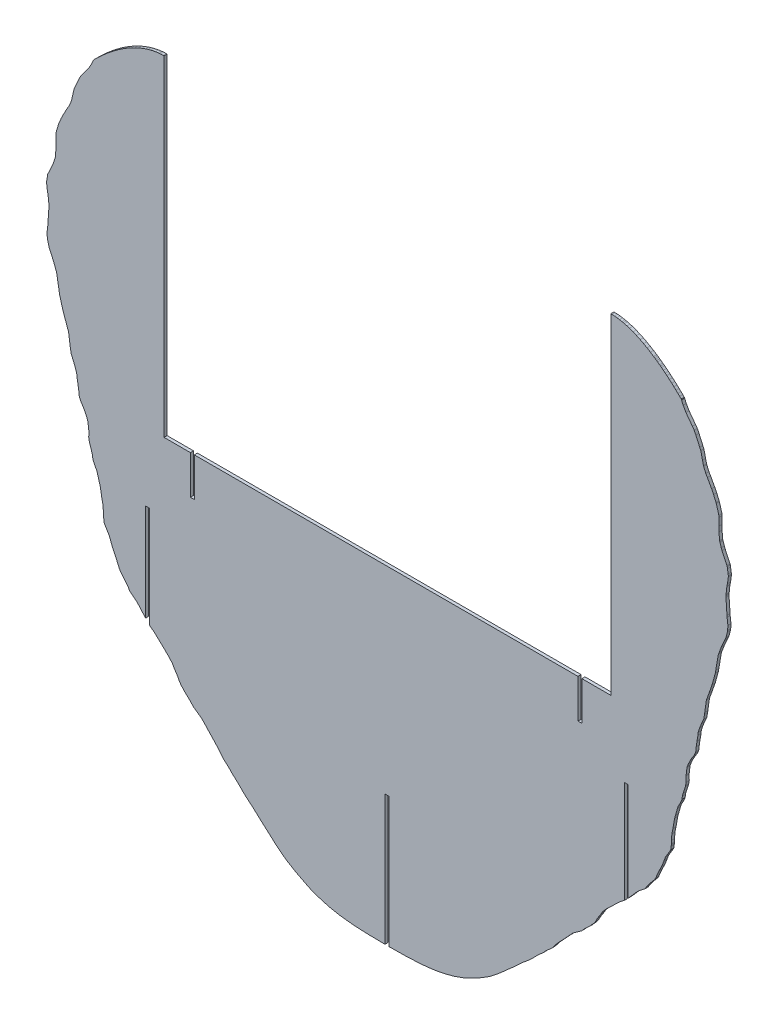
SolidWorks part; units mm, degrees
ref_plane "Спереди" through (0, 0, 0) normal (0, 0, 1) x (1, 0, 0)
ref_plane "Сверху" through (0, 0, 0) normal (0, 1, 0) x (1, 0, 0)
ref_plane "Справа" through (0, 0, 0) normal (1, 0, 0) x (0, 0, -1)
sketch "Model" plane through (0, 0, 0) normal (0, 0, 1) x (1, 0, 0)
  line L0 (-5804.3839, 836.0497) -> (-5806.3839, 836.0497)
  line L1 (-5806.3839, 836.0497) -> (-5806.6339, 836.0497)
  line L2 (-5806.6339, 836.0497) -> (-5806.6339, 751.7719)
  line L3 (-5806.6339, 751.7719) -> (-5816.1644, 751.8978)
  line L4 (-5816.1644, 751.8978) -> (-5817.4992, 751.9156)
  line L5 (-5817.4992, 751.9156) -> (-5818.2747, 751.9559)
  line L6 (-5818.2747, 751.9559) -> (-5819.9537, 752.0402)
  line L7 (-5819.9537, 752.0402) -> (-5827.1833, 752.3916)
  line L8 (-5827.1833, 752.3916) -> (-5831.1328, 752.8359)
  line L9 (-5831.1328, 752.8359) -> (-5835.7292, 753.3756)
  line L10 (-5835.7292, 753.3756) -> (-5839.8833, 754.162)
  line L11 (-5839.8833, 754.162) -> (-5842.8779, 754.7578)
  line L12 (-5842.8779, 754.7578) -> (-5845.0947, 755.3799)
  line L13 (-5845.0947, 755.3799) -> (-5848.0211, 756.1836)
  line L14 (-5848.0211, 756.1836) -> (-5851.9979, 757.5583)
  line L15 (-5851.9979, 757.5583) -> (-5854.8885, 758.6332)
  line L16 (-5854.8885, 758.6332) -> (-5857.0968, 759.7033)
  line L17 (-5857.0968, 759.7033) -> (-5864.759, 763.6433)
  line L18 (-5864.759, 763.6433) -> (-5864.8112, 763.6667)
  line L19 (-5864.8112, 763.6667) -> (-5864.8634, 763.6902)
  line L20 (-5864.8634, 763.6902) -> (-5865.4389, 764.0414)
  line L21 (-5865.4389, 764.0414) -> (-5865.5066, 764.0821)
  line L22 (-5865.5066, 764.0821) -> (-5865.5742, 764.1228)
  line L23 (-5865.5742, 764.1228) -> (-5867.9851, 765.5953)
  line L24 (-5867.9851, 765.5953) -> (-5868.5488, 765.9254)
  line L25 (-5868.5488, 765.9254) -> (-5868.84, 766.117)
  line L26 (-5868.84, 766.117) -> (-5870.1496, 766.9162)
  line L27 (-5870.1496, 766.9162) -> (-5871.8667, 768.1083)
  line L28 (-5871.8667, 768.1083) -> (-5872.1975, 768.3259)
  line L29 (-5872.1975, 768.3259) -> (-5872.3023, 768.4107)
  line L30 (-5872.3023, 768.4107) -> (-5872.502, 768.5493)
  line L31 (-5872.502, 768.5493) -> (-5873.6049, 769.4641)
  line L32 (-5873.6049, 769.4641) -> (-5875.7124, 771.1686)
  line L33 (-5875.7124, 771.1686) -> (-5878.1362, 773.0993)
  line L34 (-5878.1362, 773.0993) -> (-5879.0312, 773.9723)
  line L35 (-5879.0312, 773.9723) -> (-5879.8545, 774.6457)
  line L36 (-5879.8545, 774.6457) -> (-5881.0854, 775.8036)
  line L37 (-5881.0854, 775.8036) -> (-5885.8632, 779.979)
  line L38 (-5885.8632, 779.979) -> (-5889.2742, 783.1358)
  line L39 (-5889.2742, 783.1358) -> (-5891.3116, 784.9701)
  line L40 (-5891.3116, 784.9701) -> (-5892.251, 785.8635)
  line L41 (-5892.251, 785.8635) -> (-5892.3363, 785.9508)
  line L42 (-5892.3363, 785.9508) -> (-5892.4215, 786.0381)
  line L43 (-5892.4215, 786.0381) -> (-5892.837, 786.3891)
  line L44 (-5892.837, 786.3891) -> (-5893.2186, 786.6587)
  line L45 (-5893.2186, 786.6587) -> (-5894.3658, 787.6205)
  line L46 (-5894.3658, 787.6205) -> (-5896.5748, 789.4812)
  line L47 (-5896.5748, 789.4812) -> (-5899.043, 791.8233)
  line L48 (-5899.043, 791.8233) -> (-5901.8105, 794.6416)
  line L49 (-5901.8105, 794.6416) -> (-5903.8277, 796.489)
  line L50 (-5903.8277, 796.489) -> (-5906.0865, 798.4934)
  line L51 (-5906.0865, 798.4934) -> (-5907.1466, 799.7697)
  line L52 (-5907.1466, 799.7697) -> (-5908.1051, 800.6457)
  line L53 (-5908.1051, 800.6457) -> (-5911.608, 803.7685)
  line L54 (-5911.608, 803.7685) -> (-5914.2929, 807.2329)
  line L55 (-5914.2929, 807.2329) -> (-5914.9074, 807.9869)
  line L56 (-5914.9074, 807.9869) -> (-5924.3994, 818.1354)
  line L57 (-5924.3994, 818.1354) -> (-5924.7504, 818.5365)
  line L58 (-5924.7504, 818.5365) -> (-5924.8501, 818.6284)
  line L59 (-5924.8501, 818.6284) -> (-5924.9498, 818.7204)
  line L60 (-5924.9498, 818.7204) -> (-5925.0399, 818.8009)
  line L61 (-5925.0399, 818.8009) -> (-5925.13, 818.8814)
  line L62 (-5925.13, 818.8814) -> (-5927.2887, 820.5208)
  line L63 (-5927.2887, 820.5208) -> (-5930.7649, 822.9693)
  line L64 (-5930.7649, 822.9693) -> (-5932.802, 825.2003)
  line L65 (-5932.802, 825.2003) -> (-5933.9845, 826.4205)
  line L66 (-5933.9845, 826.4205) -> (-5935.7843, 827.9636)
  line L67 (-5935.7843, 827.9636) -> (-5936.8795, 829.2522)
  line L68 (-5936.8795, 829.2522) -> (-5937.7341, 830.2104)
  line L69 (-5937.7341, 830.2104) -> (-5938.3908, 830.8222)
  line L70 (-5938.3908, 830.8222) -> (-5938.6587, 831.1763)
  line L71 (-5938.6587, 831.1763) -> (-5939.4693, 832.2202)
  line L72 (-5939.4693, 832.2202) -> (-5941.3494, 835.6981)
  line L73 (-5941.3494, 835.6981) -> (-5943.388, 838.7749)
  line L74 (-5943.388, 838.7749) -> (-5944.0977, 840.1051)
  line L75 (-5944.0977, 840.1051) -> (-5944.212, 840.3138)
  line L76 (-5944.212, 840.3138) -> (-5944.3263, 840.5225)
  line L77 (-5944.3263, 840.5225) -> (-5945.4997, 841.8494)
  line L78 (-5945.4997, 841.8494) -> (-5947.0465, 843.5373)
  line L79 (-5947.0465, 843.5373) -> (-5947.1959, 843.6832)
  line L80 (-5947.1959, 843.6832) -> (-5953.2154, 849.4644)
  line L81 (-5953.2154, 849.4644) -> (-5955.8353, 851.9385)
  line L82 (-5955.8353, 851.9385) -> (-5956.4874, 852.4492)
  line L83 (-5956.4874, 852.4492) -> (-5958.6224, 854.0276)
  line L84 (-5958.6224, 854.0276) -> (-5959.1338, 854.482)
  line L85 (-5959.1338, 854.482) -> (-5959.1338, 920.079)
  line L86 (-5959.1338, 920.079) -> (-5959.3839, 920.079)
  line L87 (-5959.3839, 920.079) -> (-5961.3839, 920.079)
  line L88 (-5961.3839, 920.079) -> (-5961.6338, 920.079)
  line L89 (-5961.6338, 920.079) -> (-5961.6338, 857.184)
  line L90 (-5961.6338, 857.184) -> (-5964.966, 860.9151)
  line L91 (-5964.966, 860.9151) -> (-5966.7855, 863.0199)
  line L92 (-5966.7855, 863.0199) -> (-5968.0384, 864.1402)
  line L93 (-5968.0384, 864.1402) -> (-5971.9293, 867.2232)
  line L94 (-5971.9293, 867.2232) -> (-5972.0501, 867.4447)
  line L95 (-5972.0501, 867.4447) -> (-5972.1709, 867.6662)
  line L96 (-5972.1709, 867.6662) -> (-5972.774, 868.7467)
  line L97 (-5972.774, 868.7467) -> (-5974.7782, 871.3066)
  line L98 (-5974.7782, 871.3066) -> (-5974.9323, 871.5767)
  line L99 (-5974.9323, 871.5767) -> (-5975.0864, 871.8468)
  line L100 (-5975.0864, 871.8468) -> (-5975.8134, 872.6961)
  line L101 (-5975.8134, 872.6961) -> (-5978.0533, 875.3468)
  line L102 (-5978.0533, 875.3468) -> (-5978.7387, 876.5985)
  line L103 (-5978.7387, 876.5985) -> (-5980.8785, 881.6838)
  line L104 (-5980.8785, 881.6838) -> (-5980.9926, 881.8731)
  line L105 (-5980.9926, 881.8731) -> (-5981.1067, 882.0625)
  line L106 (-5981.1067, 882.0625) -> (-5982.643, 885.1963)
  line L107 (-5982.643, 885.1963) -> (-5983.9639, 888.4629)
  line L108 (-5983.9639, 888.4629) -> (-5984.2915, 889.5132)
  line L109 (-5984.2915, 889.5132) -> (-5985.1196, 891.5619)
  line L110 (-5985.1196, 891.5619) -> (-5985.6036, 892.4184)
  line L111 (-5985.6036, 892.4184) -> (-5987.355, 895.3535)
  line L112 (-5987.355, 895.3535) -> (-5988.2102, 896.7719)
  line L113 (-5988.2102, 896.7719) -> (-5988.442, 897.175)
  line L114 (-5988.442, 897.175) -> (-5988.4738, 897.3949)
  line L115 (-5988.4738, 897.3949) -> (-5988.7135, 899.2955)
  line L116 (-5988.7135, 899.2955) -> (-5988.7262, 899.3572)
  line L117 (-5988.7262, 899.3572) -> (-5988.7388, 899.4189)
  line L118 (-5988.7388, 899.4189) -> (-5988.8459, 900.1889)
  line L119 (-5988.8459, 900.1889) -> (-5988.8464, 900.2457)
  line L120 (-5988.8464, 900.2457) -> (-5988.8469, 900.3025)
  line L121 (-5988.8469, 900.3025) -> (-5988.9215, 900.6902)
  line L122 (-5988.9215, 900.6902) -> (-5988.9959, 901.078)
  line L123 (-5988.9959, 901.078) -> (-5988.9859, 902.8461)
  line L124 (-5988.9859, 902.8461) -> (-5989.1853, 906.5229)
  line L125 (-5989.1853, 906.5229) -> (-5989.9012, 909.8884)
  line L126 (-5989.9012, 909.8884) -> (-5990.9936, 916.2501)
  line L127 (-5990.9936, 916.2501) -> (-5991.5211, 918.0653)
  line L128 (-5991.5211, 918.0653) -> (-5992.83, 922.7678)
  line L129 (-5992.83, 922.7678) -> (-5993.252, 924.0637)
  line L130 (-5993.252, 924.0637) -> (-5994.1601, 925.7245)
  line L131 (-5994.1601, 925.7245) -> (-5995.1207, 927.6513)
  line L132 (-5995.1207, 927.6513) -> (-5995.8326, 929.2669)
  line L133 (-5995.8326, 929.2669) -> (-5995.9583, 931.067)
  line L134 (-5995.9583, 931.067) -> (-5996.5013, 932.9513)
  line L135 (-5996.5013, 932.9513) -> (-5998.0129, 937.6749)
  line L136 (-5998.0129, 937.6749) -> (-5998.0847, 938.1014)
  line L137 (-5998.0847, 938.1014) -> (-5998.4743, 940.2265)
  line L138 (-5998.4743, 940.2265) -> (-5998.4124, 943.7055)
  line L139 (-5998.4124, 943.7055) -> (-5998.4296, 944.146)
  line L140 (-5998.4296, 944.146) -> (-5998.9917, 948.6151)
  line L141 (-5998.9917, 948.6151) -> (-5999.1586, 949.3263)
  line L142 (-5999.1586, 949.3263) -> (-5999.83, 951.0285)
  line L143 (-5999.83, 951.0285) -> (-6001.0629, 953.631)
  line L144 (-6001.0629, 953.631) -> (-6002.2515, 955.7358)
  line L145 (-6002.2515, 955.7358) -> (-6003.6462, 957.8541)
  line L146 (-6003.6462, 957.8541) -> (-6004.3385, 959.4092)
  line L147 (-6004.3385, 959.4092) -> (-6004.6578, 960.4184)
  line L148 (-6004.6578, 960.4184) -> (-6004.9614, 963.3342)
  line L149 (-6004.9614, 963.3342) -> (-6005.453, 966.6202)
  line L150 (-6005.453, 966.6202) -> (-6005.4643, 966.6896)
  line L151 (-6005.4643, 966.6896) -> (-6005.4755, 966.7589)
  line L152 (-6005.4755, 966.7589) -> (-6006.1374, 970.4479)
  line L153 (-6006.1374, 970.4479) -> (-6006.2382, 971.868)
  line L154 (-6006.2382, 971.868) -> (-6006.2708, 972.0867)
  line L155 (-6006.2708, 972.0867) -> (-6007.2003, 974.9839)
  line L156 (-6007.2003, 974.9839) -> (-6008.3074, 977.884)
  line L157 (-6008.3074, 977.884) -> (-6009.8059, 981.2033)
  line L158 (-6009.8059, 981.2033) -> (-6010.3632, 984.2243)
  line L159 (-6010.3632, 984.2243) -> (-6010.4328, 984.77)
  line L160 (-6010.4328, 984.77) -> (-6010.5025, 985.3157)
  line L161 (-6010.5025, 985.3157) -> (-6011.5455, 992.776)
  line L162 (-6011.5455, 992.776) -> (-6013.3448, 997.7876)
  line L163 (-6013.3448, 997.7876) -> (-6015.258, 1003.2142)
  line L164 (-6015.258, 1003.2142) -> (-6017.3245, 1010.7463)
  line L165 (-6017.3245, 1010.7463) -> (-6017.3444, 1010.8489)
  line L166 (-6017.3444, 1010.8489) -> (-6017.3643, 1010.9514)
  line L167 (-6017.3643, 1010.9514) -> (-6017.6275, 1012.5505)
  line L168 (-6017.6275, 1012.5505) -> (-6019.3031, 1022.4056)
  line L169 (-6019.3031, 1022.4056) -> (-6019.9412, 1023.8694)
  line L170 (-6019.9412, 1023.8694) -> (-6021.1501, 1027.2933)
  line L171 (-6021.1501, 1027.2933) -> (-6023.4014, 1032.1994)
  line L172 (-6023.4014, 1032.1994) -> (-6024.0142, 1033.546)
  line L173 (-6024.0142, 1033.546) -> (-6024.2282, 1034.1694)
  line L174 (-6024.2282, 1034.1694) -> (-6025.2233, 1038.1004)
  line L175 (-6025.2233, 1038.1004) -> (-6025.269, 1038.4718)
  line L176 (-6025.269, 1038.4718) -> (-6025.3148, 1038.8431)
  line L177 (-6025.3148, 1038.8431) -> (-6025.4861, 1041.5935)
  line L178 (-6025.4861, 1041.5935) -> (-6024.9598, 1045.8597)
  line L179 (-6024.9598, 1045.8597) -> (-6024.8884, 1047.014)
  line L180 (-6024.8884, 1047.014) -> (-6024.2263, 1056.8146)
  line L181 (-6024.2263, 1056.8146) -> (-6024.1768, 1057.4505)
  line L182 (-6024.1768, 1057.4505) -> (-6024.1836, 1057.5831)
  line L183 (-6024.1836, 1057.5831) -> (-6024.1903, 1057.7154)
  line L184 (-6024.1903, 1057.7154) -> (-6024.3245, 1058.516)
  line L185 (-6024.3245, 1058.516) -> (-6024.8177, 1063.1317)
  line L186 (-6024.8177, 1063.1317) -> (-6025.2345, 1064.9608)
  line L187 (-6025.2345, 1064.9608) -> (-6025.7636, 1069.0267)
  line L188 (-6025.7636, 1069.0267) -> (-6025.7849, 1069.1886)
  line L189 (-6025.7849, 1069.1886) -> (-6025.8062, 1069.3504)
  line L190 (-6025.8062, 1069.3504) -> (-6025.8044, 1069.4669)
  line L191 (-6025.8044, 1069.4669) -> (-6025.7945, 1069.5785)
  line L192 (-6025.7945, 1069.5785) -> (-6025.7846, 1069.69)
  line L193 (-6025.7846, 1069.69) -> (-6025.6458, 1070.5899)
  line L194 (-6025.6458, 1070.5899) -> (-6025.2242, 1073.3153)
  line L195 (-6025.2242, 1073.3153) -> (-6025.0565, 1074.347)
  line L196 (-6025.0565, 1074.347) -> (-6025.0275, 1074.4322)
  line L197 (-6025.0275, 1074.4322) -> (-6024.9987, 1074.5174)
  line L198 (-6024.9987, 1074.5174) -> (-6024.8829, 1074.7634)
  line L199 (-6024.8829, 1074.7634) -> (-6024.7672, 1075.0094)
  line L200 (-6024.7672, 1075.0094) -> (-6021.7061, 1081.6551)
  line L201 (-6021.7061, 1081.6551) -> (-6021.1853, 1083.0296)
  line L202 (-6021.1853, 1083.0296) -> (-6020.3734, 1085.5169)
  line L203 (-6020.3734, 1085.5169) -> (-6020.1867, 1085.9986)
  line L204 (-6020.1867, 1085.9986) -> (-6020.0859, 1086.5262)
  line L205 (-6020.0859, 1086.5262) -> (-6019.7193, 1091.2474)
  line L206 (-6019.7193, 1091.2474) -> (-6019.676, 1094.4)
  line L207 (-6019.676, 1094.4) -> (-6019.7209, 1099.3265)
  line L208 (-6019.7209, 1099.3265) -> (-6019.6312, 1100.5154)
  line L209 (-6019.6312, 1100.5154) -> (-6017.9762, 1106.2511)
  line L210 (-6017.9762, 1106.2511) -> (-6017.8916, 1106.4439)
  line L211 (-6017.8916, 1106.4439) -> (-6017.807, 1106.6369)
  line L212 (-6017.807, 1106.6369) -> (-6016.2192, 1110.3697)
  line L213 (-6016.2192, 1110.3697) -> (-6014.9184, 1113.0326)
  line L214 (-6014.9184, 1113.0326) -> (-6012.2263, 1117.9522)
  line L215 (-6012.2263, 1117.9522) -> (-6011.1822, 1119.7015)
  line L216 (-6011.1822, 1119.7015) -> (-6009.7951, 1123.0426)
  line L217 (-6009.7951, 1123.0426) -> (-6009.6511, 1123.3592)
  line L218 (-6009.6511, 1123.3592) -> (-6009.0478, 1126.0429)
  line L219 (-6009.0478, 1126.0429) -> (-6007.9239, 1130.9686)
  line L220 (-6007.9239, 1130.9686) -> (-6007.26, 1132.398)
  line L221 (-6007.26, 1132.398) -> (-6004.7557, 1138.0055)
  line L222 (-6004.7557, 1138.0055) -> (-6003.6607, 1140.2436)
  line L223 (-6003.6607, 1140.2436) -> (-6002.5034, 1141.855)
  line L224 (-6002.5034, 1141.855) -> (-5998.3656, 1147.4083)
  line L225 (-5998.3656, 1147.4083) -> (-5996.5661, 1150.6158)
  line L226 (-5996.5661, 1150.6158) -> (-5995.5018, 1152.9276)
  line L227 (-5995.5018, 1152.9276) -> (-5995.435, 1153.0099)
  line L228 (-5995.435, 1153.0099) -> (-5995.2473, 1153.5038)
  line L229 (-5995.2473, 1153.5038) -> (-5994.2278, 1154.5143)
  line L230 (-5994.2278, 1154.5143) -> (-5993.1001, 1155.6102)
  line L231 (-5993.1001, 1155.6102) -> (-5991.8687, 1156.7803)
  line L232 (-5991.8687, 1156.7803) -> (-5990.5382, 1158.0133)
  line L233 (-5990.5382, 1158.0133) -> (-5989.1133, 1159.2981)
  line L234 (-5989.1133, 1159.2981) -> (-5987.5984, 1160.6231)
  line L235 (-5987.5984, 1160.6231) -> (-5985.9981, 1161.9774)
  line L236 (-5985.9981, 1161.9774) -> (-5984.8659, 1162.9073)
  line L237 (-5984.8659, 1162.9073) -> (-5983.6978, 1163.8418)
  line L238 (-5983.6978, 1163.8418) -> (-5982.4954, 1164.7773)
  line L239 (-5982.4954, 1164.7773) -> (-5981.8778, 1165.244)
  line L240 (-5981.8778, 1165.244) -> (-5981.2601, 1165.7105)
  line L241 (-5981.2601, 1165.7105) -> (-5979.9932, 1166.6378)
  line L242 (-5979.9932, 1166.6378) -> (-5979.3448, 1167.0968)
  line L243 (-5979.3448, 1167.0968) -> (-5978.6964, 1167.5559)
  line L244 (-5978.6964, 1167.5559) -> (-5978.0336, 1168.0084)
  line L245 (-5978.0336, 1168.0084) -> (-5977.3709, 1168.4608)
  line L246 (-5977.3709, 1168.4608) -> (-5975.2792, 1169.8194)
  line L247 (-5975.2792, 1169.8194) -> (-5973.1284, 1171.1263)
  line L248 (-5973.1284, 1171.1263) -> (-5970.9235, 1172.3683)
  line L249 (-5970.9235, 1172.3683) -> (-5968.67, 1173.5328)
  line L250 (-5968.67, 1173.5328) -> (-5966.3729, 1174.6068)
  line L251 (-5966.3729, 1174.6068) -> (-5964.0374, 1175.5777)
  line L252 (-5964.0374, 1175.5777) -> (-5961.6688, 1176.4325)
  line L253 (-5961.6688, 1176.4325) -> (-5960.0828, 1176.9288)
  line L254 (-5960.0828, 1176.9288) -> (-5958.4856, 1177.3651)
  line L255 (-5958.4856, 1177.3651) -> (-5956.8786, 1177.7374)
  line L256 (-5956.8786, 1177.7374) -> (-5955.2639, 1178.0416)
  line L257 (-5955.2639, 1178.0416) -> (-5953.6431, 1178.2743)
  line L258 (-5953.6431, 1178.2743) -> (-5952.8305, 1178.3529)
  line L259 (-5952.8305, 1178.3529) -> (-5952.0179, 1178.4316)
  line L260 (-5952.0179, 1178.4316) -> (-5950.39, 1178.5095)
  line L261 (-5950.39, 1178.5095) -> (-5950.0315, 1178.5128)
  line L262 (-5950.0315, 1178.5128) -> (-5949.6728, 1178.516)
  line L263 (-5949.6728, 1178.516) -> (-5949.6728, 964.5249)
  line L264 (-5949.6728, 964.5249) -> (-5932.6339, 964.5249)
  line L265 (-5932.6339, 964.5249) -> (-5932.6339, 939.4676)
  line L266 (-5932.6339, 939.4676) -> (-5932.3839, 939.4676)
  line L267 (-5932.3839, 939.4676) -> (-5930.3839, 939.4676)
  line L268 (-5930.3839, 939.4676) -> (-5930.1339, 939.4676)
  line L269 (-5930.1339, 939.4676) -> (-5930.1339, 964.5249)
  line L270 (-5930.1339, 964.5249) -> (-5681.634, 964.5249)
  line L271 (-5681.634, 964.5249) -> (-5681.634, 939.4676)
  line L272 (-5681.634, 939.4676) -> (-5681.3839, 939.4676)
  line L273 (-5681.3839, 939.4676) -> (-5679.3839, 939.4676)
  line L274 (-5679.3839, 939.4676) -> (-5679.134, 939.4676)
  line L275 (-5679.134, 939.4676) -> (-5679.134, 964.5249)
  line L276 (-5679.134, 964.5249) -> (-5660.3839, 964.5249)
  line L277 (-5660.3839, 964.5249) -> (-5660.3839, 1178.516)
  line L278 (-5660.3839, 1178.516) -> (-5659.6697, 1178.5096)
  line L279 (-5659.6697, 1178.5096) -> (-5658.0416, 1178.4317)
  line L280 (-5658.0416, 1178.4317) -> (-5656.4159, 1178.2745)
  line L281 (-5656.4159, 1178.2745) -> (-5655.6052, 1178.1581)
  line L282 (-5655.6052, 1178.1581) -> (-5654.7945, 1178.0417)
  line L283 (-5654.7945, 1178.0417) -> (-5653.1792, 1177.7373)
  line L284 (-5653.1792, 1177.7373) -> (-5652.3754, 1177.5511)
  line L285 (-5652.3754, 1177.5511) -> (-5651.5717, 1177.3651)
  line L286 (-5651.5717, 1177.3651) -> (-5649.9739, 1176.9288)
  line L287 (-5649.9739, 1176.9288) -> (-5648.3878, 1176.4325)
  line L288 (-5648.3878, 1176.4325) -> (-5646.0192, 1175.5777)
  line L289 (-5646.0192, 1175.5777) -> (-5643.6836, 1174.607)
  line L290 (-5643.6836, 1174.607) -> (-5641.3866, 1173.5328)
  line L291 (-5641.3866, 1173.5328) -> (-5639.133, 1172.3683)
  line L292 (-5639.133, 1172.3683) -> (-5636.9283, 1171.1261)
  line L293 (-5636.9283, 1171.1261) -> (-5634.7774, 1169.8194)
  line L294 (-5634.7774, 1169.8194) -> (-5632.6858, 1168.4608)
  line L295 (-5632.6858, 1168.4608) -> (-5632.023, 1168.0084)
  line L296 (-5632.023, 1168.0084) -> (-5631.3602, 1167.5559)
  line L297 (-5631.3602, 1167.5559) -> (-5630.7117, 1167.097)
  line L298 (-5630.7117, 1167.097) -> (-5630.0633, 1166.638)
  line L299 (-5630.0633, 1166.638) -> (-5628.7965, 1165.7105)
  line L300 (-5628.7965, 1165.7105) -> (-5628.1789, 1165.244)
  line L301 (-5628.1789, 1165.244) -> (-5627.5612, 1164.7773)
  line L302 (-5627.5612, 1164.7773) -> (-5626.3588, 1163.8417)
  line L303 (-5626.3588, 1163.8417) -> (-5625.1908, 1162.9072)
  line L304 (-5625.1908, 1162.9072) -> (-5624.0585, 1161.9774)
  line L305 (-5624.0585, 1161.9774) -> (-5622.4581, 1160.6234)
  line L306 (-5622.4581, 1160.6234) -> (-5620.9433, 1159.2981)
  line L307 (-5620.9433, 1159.2981) -> (-5619.5184, 1158.0133)
  line L308 (-5619.5184, 1158.0133) -> (-5618.1879, 1156.7803)
  line L309 (-5618.1879, 1156.7803) -> (-5616.9566, 1155.6101)
  line L310 (-5616.9566, 1155.6101) -> (-5615.8288, 1154.5143)
  line L311 (-5615.8288, 1154.5143) -> (-5614.8093, 1153.5038)
  line L312 (-5614.8093, 1153.5038) -> (-5614.6216, 1153.0099)
  line L313 (-5614.6216, 1153.0099) -> (-5614.5549, 1152.9276)
  line L314 (-5614.5549, 1152.9276) -> (-5613.4905, 1150.6158)
  line L315 (-5613.4905, 1150.6158) -> (-5611.6911, 1147.4083)
  line L316 (-5611.6911, 1147.4083) -> (-5607.5533, 1141.855)
  line L317 (-5607.5533, 1141.855) -> (-5606.396, 1140.2436)
  line L318 (-5606.396, 1140.2436) -> (-5605.301, 1138.0055)
  line L319 (-5605.301, 1138.0055) -> (-5602.7967, 1132.398)
  line L320 (-5602.7967, 1132.398) -> (-5602.1327, 1130.9686)
  line L321 (-5602.1327, 1130.9686) -> (-5601.0087, 1126.0429)
  line L322 (-5601.0087, 1126.0429) -> (-5600.4056, 1123.3592)
  line L323 (-5600.4056, 1123.3592) -> (-5600.2615, 1123.0426)
  line L324 (-5600.2615, 1123.0426) -> (-5598.8744, 1119.7015)
  line L325 (-5598.8744, 1119.7015) -> (-5597.8303, 1117.9522)
  line L326 (-5597.8303, 1117.9522) -> (-5595.1382, 1113.0326)
  line L327 (-5595.1382, 1113.0326) -> (-5593.8374, 1110.3697)
  line L328 (-5593.8374, 1110.3697) -> (-5592.2496, 1106.6369)
  line L329 (-5592.2496, 1106.6369) -> (-5592.1651, 1106.4439)
  line L330 (-5592.1651, 1106.4439) -> (-5592.0805, 1106.2511)
  line L331 (-5592.0805, 1106.2511) -> (-5590.4255, 1100.5154)
  line L332 (-5590.4255, 1100.5154) -> (-5590.3357, 1099.3265)
  line L333 (-5590.3357, 1099.3265) -> (-5590.3807, 1094.4)
  line L334 (-5590.3807, 1094.4) -> (-5590.3373, 1091.2474)
  line L335 (-5590.3373, 1091.2474) -> (-5589.9707, 1086.5262)
  line L336 (-5589.9707, 1086.5262) -> (-5589.8699, 1085.9986)
  line L337 (-5589.8699, 1085.9986) -> (-5589.6832, 1085.5169)
  line L338 (-5589.6832, 1085.5169) -> (-5588.8714, 1083.0296)
  line L339 (-5588.8714, 1083.0296) -> (-5588.3504, 1081.6551)
  line L340 (-5588.3504, 1081.6551) -> (-5585.2895, 1075.0094)
  line L341 (-5585.2895, 1075.0094) -> (-5585.0579, 1074.5174)
  line L342 (-5585.0579, 1074.5174) -> (-5585.0002, 1074.347)
  line L343 (-5585.0002, 1074.347) -> (-5584.8324, 1073.3153)
  line L344 (-5584.8324, 1073.3153) -> (-5584.4108, 1070.5899)
  line L345 (-5584.4108, 1070.5899) -> (-5584.2755, 1069.7269)
  line L346 (-5584.2755, 1069.7269) -> (-5584.2523, 1069.4669)
  line L347 (-5584.2523, 1069.4669) -> (-5584.2504, 1069.3553)
  line L348 (-5584.2504, 1069.3553) -> (-5584.293, 1069.0267)
  line L349 (-5584.293, 1069.0267) -> (-5584.8222, 1064.9608)
  line L350 (-5584.8222, 1064.9608) -> (-5585.239, 1063.1317)
  line L351 (-5585.239, 1063.1317) -> (-5585.7322, 1058.516)
  line L352 (-5585.7322, 1058.516) -> (-5585.8663, 1057.7154)
  line L353 (-5585.8663, 1057.7154) -> (-5585.8798, 1057.4505)
  line L354 (-5585.8798, 1057.4505) -> (-5585.8303, 1056.8146)
  line L355 (-5585.8303, 1056.8146) -> (-5585.1682, 1047.014)
  line L356 (-5585.1682, 1047.014) -> (-5585.0969, 1045.8597)
  line L357 (-5585.0969, 1045.8597) -> (-5584.5705, 1041.5935)
  line L358 (-5584.5705, 1041.5935) -> (-5584.7419, 1038.8431)
  line L359 (-5584.7419, 1038.8431) -> (-5584.8333, 1038.1004)
  line L360 (-5584.8333, 1038.1004) -> (-5585.8284, 1034.1694)
  line L361 (-5585.8284, 1034.1694) -> (-5586.0424, 1033.546)
  line L362 (-5586.0424, 1033.546) -> (-5586.6552, 1032.1994)
  line L363 (-5586.6552, 1032.1994) -> (-5588.9065, 1027.2933)
  line L364 (-5588.9065, 1027.2933) -> (-5590.1154, 1023.8694)
  line L365 (-5590.1154, 1023.8694) -> (-5590.7536, 1022.4056)
  line L366 (-5590.7536, 1022.4056) -> (-5592.4292, 1012.5505)
  line L367 (-5592.4292, 1012.5505) -> (-5592.6923, 1010.9514)
  line L368 (-5592.6923, 1010.9514) -> (-5592.7321, 1010.7463)
  line L369 (-5592.7321, 1010.7463) -> (-5594.7986, 1003.2142)
  line L370 (-5594.7986, 1003.2142) -> (-5596.7119, 997.7876)
  line L371 (-5596.7119, 997.7876) -> (-5598.5111, 992.776)
  line L372 (-5598.5111, 992.776) -> (-5599.5541, 985.3157)
  line L373 (-5599.5541, 985.3157) -> (-5599.6934, 984.2243)
  line L374 (-5599.6934, 984.2243) -> (-5600.2508, 981.2033)
  line L375 (-5600.2508, 981.2033) -> (-5601.7492, 977.884)
  line L376 (-5601.7492, 977.884) -> (-5602.8563, 974.9839)
  line L377 (-5602.8563, 974.9839) -> (-5603.7844, 972.0929)
  line L378 (-5603.7844, 972.0929) -> (-5603.8184, 971.868)
  line L379 (-5603.8184, 971.868) -> (-5603.9193, 970.4479)
  line L380 (-5603.9193, 970.4479) -> (-5604.5811, 966.7589)
  line L381 (-5604.5811, 966.7589) -> (-5604.6036, 966.6202)
  line L382 (-5604.6036, 966.6202) -> (-5605.0953, 963.3342)
  line L383 (-5605.0953, 963.3342) -> (-5605.3988, 960.4184)
  line L384 (-5605.3988, 960.4184) -> (-5605.7182, 959.4092)
  line L385 (-5605.7182, 959.4092) -> (-5606.4105, 957.8541)
  line L386 (-5606.4105, 957.8541) -> (-5607.8051, 955.7358)
  line L387 (-5607.8051, 955.7358) -> (-5608.9937, 953.631)
  line L388 (-5608.9937, 953.631) -> (-5610.2265, 951.0285)
  line L389 (-5610.2265, 951.0285) -> (-5610.898, 949.3263)
  line L390 (-5610.898, 949.3263) -> (-5611.065, 948.6151)
  line L391 (-5611.065, 948.6151) -> (-5611.627, 944.146)
  line L392 (-5611.627, 944.146) -> (-5611.6442, 943.7055)
  line L393 (-5611.6442, 943.7055) -> (-5611.5824, 940.2265)
  line L394 (-5611.5824, 940.2265) -> (-5611.9719, 938.1014)
  line L395 (-5611.9719, 938.1014) -> (-5612.0437, 937.6749)
  line L396 (-5612.0437, 937.6749) -> (-5613.5554, 932.9513)
  line L397 (-5613.5554, 932.9513) -> (-5614.0983, 931.067)
  line L398 (-5614.0983, 931.067) -> (-5614.2241, 929.2669)
  line L399 (-5614.2241, 929.2669) -> (-5614.9359, 927.6513)
  line L400 (-5614.9359, 927.6513) -> (-5615.8965, 925.7245)
  line L401 (-5615.8965, 925.7245) -> (-5616.8046, 924.0637)
  line L402 (-5616.8046, 924.0637) -> (-5617.2266, 922.7678)
  line L403 (-5617.2266, 922.7678) -> (-5618.5355, 918.0653)
  line L404 (-5618.5355, 918.0653) -> (-5619.0631, 916.2501)
  line L405 (-5619.0631, 916.2501) -> (-5620.1554, 909.8884)
  line L406 (-5620.1554, 909.8884) -> (-5620.8714, 906.5229)
  line L407 (-5620.8714, 906.5229) -> (-5621.0707, 902.8461)
  line L408 (-5621.0707, 902.8461) -> (-5621.0607, 901.078)
  line L409 (-5621.0607, 901.078) -> (-5621.2097, 900.3025)
  line L410 (-5621.2097, 900.3025) -> (-5621.2108, 900.1889)
  line L411 (-5621.2108, 900.1889) -> (-5621.3177, 899.4189)
  line L412 (-5621.3177, 899.4189) -> (-5621.3432, 899.2955)
  line L413 (-5621.3432, 899.2955) -> (-5621.5828, 897.3949)
  line L414 (-5621.5828, 897.3949) -> (-5621.6147, 897.175)
  line L415 (-5621.6147, 897.175) -> (-5621.8465, 896.7719)
  line L416 (-5621.8465, 896.7719) -> (-5622.7016, 895.3535)
  line L417 (-5622.7016, 895.3535) -> (-5624.4531, 892.4184)
  line L418 (-5624.4531, 892.4184) -> (-5624.937, 891.5619)
  line L419 (-5624.937, 891.5619) -> (-5625.7652, 889.5132)
  line L420 (-5625.7652, 889.5132) -> (-5626.0927, 888.4629)
  line L421 (-5626.0927, 888.4629) -> (-5627.4136, 885.1963)
  line L422 (-5627.4136, 885.1963) -> (-5628.95, 882.0625)
  line L423 (-5628.95, 882.0625) -> (-5629.1781, 881.6838)
  line L424 (-5629.1781, 881.6838) -> (-5631.318, 876.5985)
  line L425 (-5631.318, 876.5985) -> (-5632.0033, 875.3468)
  line L426 (-5632.0033, 875.3468) -> (-5634.2433, 872.6961)
  line L427 (-5634.2433, 872.6961) -> (-5634.9702, 871.8468)
  line L428 (-5634.9702, 871.8468) -> (-5635.2785, 871.3066)
  line L429 (-5635.2785, 871.3066) -> (-5637.2826, 868.7467)
  line L430 (-5637.2826, 868.7467) -> (-5637.8858, 867.6662)
  line L431 (-5637.8858, 867.6662) -> (-5638.1093, 867.2453)
  line L432 (-5638.1093, 867.2453) -> (-5642.0182, 864.1402)
  line L433 (-5642.0182, 864.1402) -> (-5643.2712, 863.0199)
  line L434 (-5643.2712, 863.0199) -> (-5645.0907, 860.9151)
  line L435 (-5645.0907, 860.9151) -> (-5649.1339, 856.3877)
  line L436 (-5649.1339, 856.3877) -> (-5649.1339, 920.079)
  line L437 (-5649.1339, 920.079) -> (-5649.3839, 920.079)
  line L438 (-5649.3839, 920.079) -> (-5651.3839, 920.079)
  line L439 (-5651.3839, 920.079) -> (-5651.6339, 920.079)
  line L440 (-5651.6339, 920.079) -> (-5651.6339, 853.88)
  line L441 (-5651.6339, 853.88) -> (-5653.5692, 852.4492)
  line L442 (-5653.5692, 852.4492) -> (-5654.2213, 851.9385)
  line L443 (-5654.2213, 851.9385) -> (-5656.8412, 849.4644)
  line L444 (-5656.8412, 849.4644) -> (-5662.8607, 843.6832)
  line L445 (-5662.8607, 843.6832) -> (-5663.0102, 843.5373)
  line L446 (-5663.0102, 843.5373) -> (-5664.5569, 841.8494)
  line L447 (-5664.5569, 841.8494) -> (-5665.7303, 840.5225)
  line L448 (-5665.7303, 840.5225) -> (-5665.8446, 840.3138)
  line L449 (-5665.8446, 840.3138) -> (-5665.9589, 840.1051)
  line L450 (-5665.9589, 840.1051) -> (-5666.6686, 838.7749)
  line L451 (-5666.6686, 838.7749) -> (-5668.7072, 835.6981)
  line L452 (-5668.7072, 835.6981) -> (-5670.5873, 832.2202)
  line L453 (-5670.5873, 832.2202) -> (-5671.3979, 831.1763)
  line L454 (-5671.3979, 831.1763) -> (-5671.5319, 830.9992)
  line L455 (-5671.5319, 830.9992) -> (-5671.6658, 830.8222)
  line L456 (-5671.6658, 830.8222) -> (-5672.3226, 830.2104)
  line L457 (-5672.3226, 830.2104) -> (-5673.1771, 829.2522)
  line L458 (-5673.1771, 829.2522) -> (-5674.2724, 827.9636)
  line L459 (-5674.2724, 827.9636) -> (-5676.0722, 826.4205)
  line L460 (-5676.0722, 826.4205) -> (-5677.2547, 825.2003)
  line L461 (-5677.2547, 825.2003) -> (-5679.2918, 822.9693)
  line L462 (-5679.2918, 822.9693) -> (-5682.768, 820.5208)
  line L463 (-5682.768, 820.5208) -> (-5684.9266, 818.8814)
  line L464 (-5684.9266, 818.8814) -> (-5685.0167, 818.8009)
  line L465 (-5685.0167, 818.8009) -> (-5685.1069, 818.7204)
  line L466 (-5685.1069, 818.7204) -> (-5685.2065, 818.6284)
  line L467 (-5685.2065, 818.6284) -> (-5685.3062, 818.5365)
  line L468 (-5685.3062, 818.5365) -> (-5685.6572, 818.1354)
  line L469 (-5685.6572, 818.1354) -> (-5695.1492, 807.9869)
  line L470 (-5695.1492, 807.9869) -> (-5695.7638, 807.2329)
  line L471 (-5695.7638, 807.2329) -> (-5698.4487, 803.7685)
  line L472 (-5698.4487, 803.7685) -> (-5701.9515, 800.6457)
  line L473 (-5701.9515, 800.6457) -> (-5702.91, 799.7697)
  line L474 (-5702.91, 799.7697) -> (-5703.9701, 798.4934)
  line L475 (-5703.9701, 798.4934) -> (-5706.2289, 796.489)
  line L476 (-5706.2289, 796.489) -> (-5708.2461, 794.6416)
  line L477 (-5708.2461, 794.6416) -> (-5711.0136, 791.8233)
  line L478 (-5711.0136, 791.8233) -> (-5713.4818, 789.4812)
  line L479 (-5713.4818, 789.4812) -> (-5715.6908, 787.6205)
  line L480 (-5715.6908, 787.6205) -> (-5716.8381, 786.6587)
  line L481 (-5716.8381, 786.6587) -> (-5717.2196, 786.3891)
  line L482 (-5717.2196, 786.3891) -> (-5717.6351, 786.0381)
  line L483 (-5717.6351, 786.0381) -> (-5717.7204, 785.9508)
  line L484 (-5717.7204, 785.9508) -> (-5717.8057, 785.8635)
  line L485 (-5717.8057, 785.8635) -> (-5718.745, 784.9701)
  line L486 (-5718.745, 784.9701) -> (-5720.7825, 783.1358)
  line L487 (-5720.7825, 783.1358) -> (-5724.1934, 779.979)
  line L488 (-5724.1934, 779.979) -> (-5728.9712, 775.8036)
  line L489 (-5728.9712, 775.8036) -> (-5730.2022, 774.6457)
  line L490 (-5730.2022, 774.6457) -> (-5731.0254, 773.9723)
  line L491 (-5731.0254, 773.9723) -> (-5731.9204, 773.0993)
  line L492 (-5731.9204, 773.0993) -> (-5734.3443, 771.1686)
  line L493 (-5734.3443, 771.1686) -> (-5736.4517, 769.4641)
  line L494 (-5736.4517, 769.4641) -> (-5737.5546, 768.5493)
  line L495 (-5737.5546, 768.5493) -> (-5737.6544, 768.48)
  line L496 (-5737.6544, 768.48) -> (-5737.7543, 768.4107)
  line L497 (-5737.7543, 768.4107) -> (-5737.8067, 768.3683)
  line L498 (-5737.8067, 768.3683) -> (-5737.8592, 768.3259)
  line L499 (-5737.8592, 768.3259) -> (-5738.19, 768.1083)
  line L500 (-5738.19, 768.1083) -> (-5739.907, 766.9162)
  line L501 (-5739.907, 766.9162) -> (-5741.2166, 766.117)
  line L502 (-5741.2166, 766.117) -> (-5741.5079, 765.9254)
  line L503 (-5741.5079, 765.9254) -> (-5742.0715, 765.5953)
  line L504 (-5742.0715, 765.5953) -> (-5744.4824, 764.1228)
  line L505 (-5744.4824, 764.1228) -> (-5744.6177, 764.0414)
  line L506 (-5744.6177, 764.0414) -> (-5745.1933, 763.6902)
  line L507 (-5745.1933, 763.6902) -> (-5745.2454, 763.6667)
  line L508 (-5745.2454, 763.6667) -> (-5745.2976, 763.6433)
  line L509 (-5745.2976, 763.6433) -> (-5752.9599, 759.7033)
  line L510 (-5752.9599, 759.7033) -> (-5755.1681, 758.6332)
  line L511 (-5755.1681, 758.6332) -> (-5758.0587, 757.5583)
  line L512 (-5758.0587, 757.5583) -> (-5762.0356, 756.1836)
  line L513 (-5762.0356, 756.1836) -> (-5764.962, 755.3799)
  line L514 (-5764.962, 755.3799) -> (-5767.1788, 754.7578)
  line L515 (-5767.1788, 754.7578) -> (-5770.1734, 754.162)
  line L516 (-5770.1734, 754.162) -> (-5774.3274, 753.3756)
  line L517 (-5774.3274, 753.3756) -> (-5778.9239, 752.8359)
  line L518 (-5778.9239, 752.8359) -> (-5782.8733, 752.3916)
  line L519 (-5782.8733, 752.3916) -> (-5790.1029, 752.0402)
  line L520 (-5790.1029, 752.0402) -> (-5791.7819, 751.9559)
  line L521 (-5791.7819, 751.9559) -> (-5792.5574, 751.9156)
  line L522 (-5792.5574, 751.9156) -> (-5793.8922, 751.8978)
  line L523 (-5793.8922, 751.8978) -> (-5804.1339, 751.7623)
  line L524 (-5804.1339, 751.7623) -> (-5804.1339, 836.0497)
  line L525 (-5804.1339, 836.0497) -> (-5804.3839, 836.0497)
extrude "Бобышка-Вытянуть1" add sketch "Model" along normal blind 2
